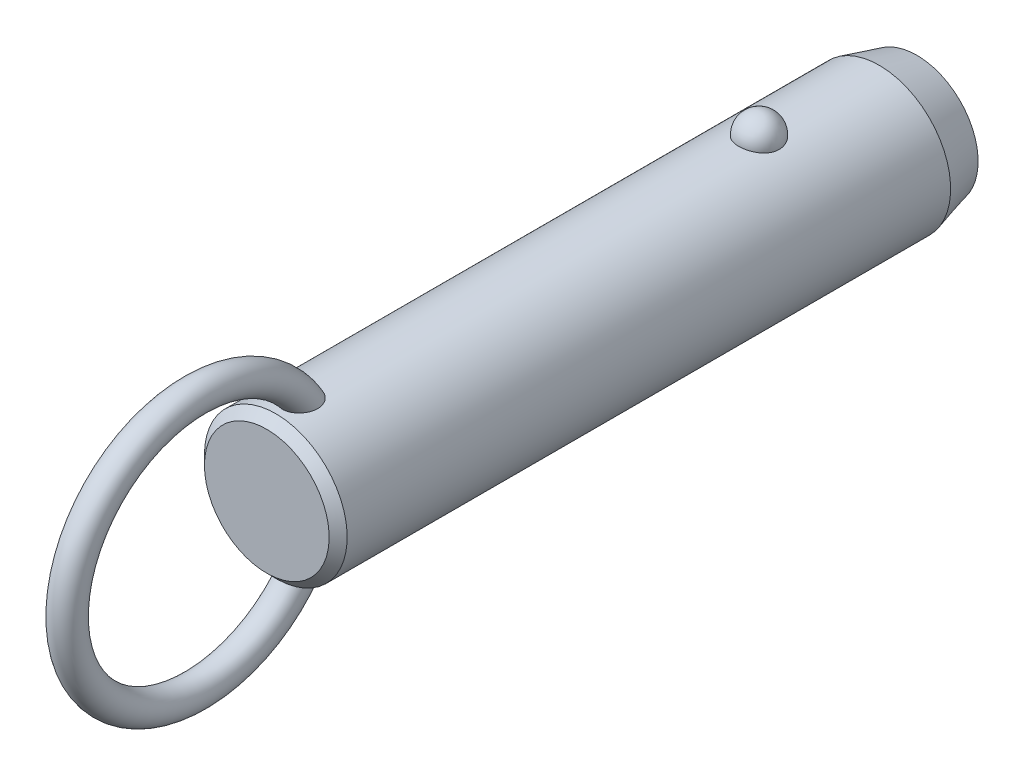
SolidWorks part; units mm, degrees
ref_plane "Front Plane" through (0, 0, 0) normal (0, 0, 1) x (1, 0, 0)
ref_plane "Top Plane" through (0, 0, 0) normal (0, 1, 0) x (1, 0, 0)
ref_plane "Right Plane" through (0, 0, 0) normal (1, 0, 0) x (0, 0, -1)
sketch "Sketch2" plane through (0, 0, 0) normal (0, 0, 1) x (1, 0, 0)
  circle A0 centre (0, 0) radius 9.5
  point P3 (0, 9.5)
  dimension "D1" = 19
extrude "Boss-Extrude1" add sketch "Sketch2" along normal blind 53.3
sketch "Sketch3" plane through (0, 0, 0) normal (0, 0, -1) x (-1, 0, 0)
  circle A0 centre (0, 0) radius 9.5
  dimension "D1" = 19
extrude "Boss-Extrude2" add sketch "Sketch3" along normal blind 23.7
chamfer "Chamfer1" distance 5 angle 15 1 edges at (-9.5, 0, -23.7)
sketch "Sketch12" plane through (0, 0, 0) normal (1, 0, 0) x (0, 0, -1)
  line L0 (-53.3, 9.5) -> (-53.3, -9.5) construction
  point P0 (-53.3, 0)
sketch "Sketch13" plane through (0, 0, 0) normal (1, 0, 0) x (0, 0, -1)
  circle A0 centre (-72.35, 0) radius 19.05
  point P2 (-53.3, 0)
  dimension "D1" = 38.1
sketch "Sketch14" plane through (0, 0, 0) normal (0, 1, 0) x (1, 0, 0)
  circle A0 centre (0, -55.3) radius 2
  point P2 (0, -53.3)
  dimension "D1" = 4
sweep "Sweep1" add profiles "Sketch14" path "Sketch13"
sketch "Sketch15" plane through (0, 0, 53.3) normal (0, 0, 1) x (1, 0, 0)
  circle A0 centre (0, 0) radius 9.5
  dimension "D1" = 19
extrude "Boss-Extrude3" add sketch "Sketch15" along normal blind 9.52
chamfer "Chamfer2" distance 1.2 angle 45 1 edges at (9.5, 0, 62.82)
sketch "Sketch18" plane through (0, 0, 0) normal (1, 0, 0) x (0, 0, -1)
  line L0 (18.7, 9.5) -> (-55.8378, 9.5) construction
  line L1 (2.7, 12.2) -> (2.7, 6.8)
  line L2 (-55.8378, -9.5) -> (18.7, -9.5) construction
  arc A0 (2.7, 12.2) -> (2.7, 6.8) centre (2.7, 9.5) ccw
  point P4 (0, 9.5)
  dimension "D1" = 21.7
revolve "Revolve1" add sketch "Sketch18" angle 360 about L1
